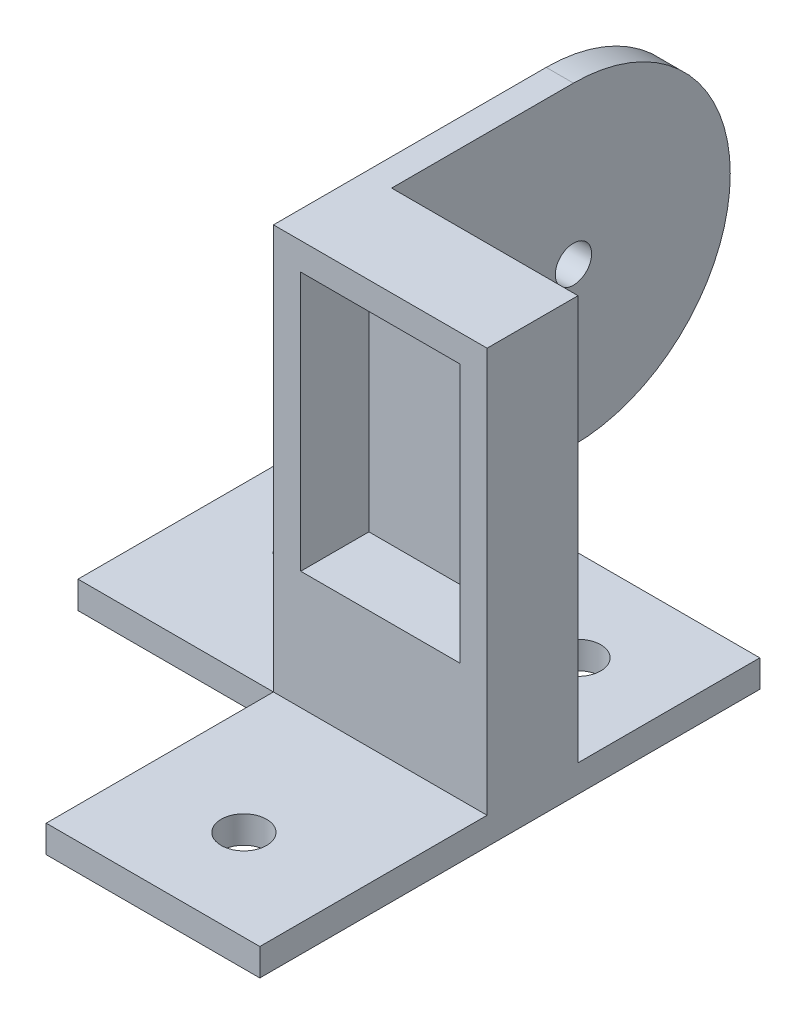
SolidWorks part; units mm, degrees
ref_plane "Alzado" through (0, 0, 0) normal (0, 0, 1) x (1, 0, 0)
ref_plane "Planta" through (0, 0, 0) normal (0, 1, 0) x (1, 0, 0)
ref_plane "Vista lateral" through (0, 0, 0) normal (1, 0, 0) x (0, 0, -1)
sketch "Croquis1" plane through (0, 0, 0) normal (0, 0, 1) x (1, 0, 0)
  line L0 (-11.75, 17.5) -> (-11.75, -17)
  line L1 (-8.75, 14.5) -> (8.75, 14.5)
  line L2 (-8.75, 14.5) -> (-8.75, -14)
  line L3 (-8.75, -14) -> (8.75, -14)
  line L4 (8.75, 14.5) -> (8.75, -14)
  line L5 (-11.75, -17) -> (11.75, -17)
  line L6 (11.75, 17.5) -> (11.75, -17)
  line L7 (-11.75, 17.5) -> (11.75, 17.5)
  dimension "D1" = 8.75
  dimension "D2" = 17.5
  dimension "D3" = 14.5
  dimension "D4" = 28.5
  dimension "D5" = 3
extrude "Saliente-Extruir1" add sketch "Croquis1" along normal blind 10
sketch "Croquis2" plane through (-11.75, 0, 0) normal (-1, 0, 0) x (0, 0, 1)
  line L1 (0, 17.5) -> (-20, 17.5)
  line L2 (0, 17.5) -> (0, -17)
  line L3 (0, -17) -> (-20, -17)
  arc A0 (-20, 17.5) -> (-20, -17) centre (-20, 0.25) ccw
  circle A1 centre (-20, 0.25) radius 2
  dimension "D3" = 4
  dimension "D1" = 34.5
  dimension "D2" = 20
extrude "Saliente-Extruir2" add sketch "Croquis2" against normal up to surface (3 mm away)
sketch "Croquis3" plane through (0, -17, 0) normal (0, -1, 0) x (1, 0, 0)
  line L12 (-11.75, 10) -> (-11.75, -20)
  line L13 (-11.75, -20) -> (-8.75, -20)
  line L14 (-8.75, -20) -> (-8.75, 0)
  line L15 (-8.75, 0) -> (11.75, 0)
  line L16 (11.75, 0) -> (11.75, 10)
  line L17 (11.75, 10) -> (-11.75, 10)
  line L18 (-11.75, 10) -> (-11.75, -20)
  line L19 (-11.75, -20) -> (-8.75, -20)
  line L20 (-8.75, -20) -> (-8.75, 0)
  line L21 (-8.75, 0) -> (11.75, 0)
  line L22 (11.75, 0) -> (11.75, 10)
  line L23 (11.75, 10) -> (-11.75, 10)
  dimension "D1" = 0
extrude "Saliente-Extruir3" add sketch "Croquis3" along normal blind 10
sketch "Croquis4" plane through (0, -27, 0) normal (0, -1, 0) x (1, 0, 0)
  line L1 (-11.75, -20) -> (-33.25, -20)
  line L2 (-11.75, 10) -> (-11.75, 10.0008)
  line L3 (-11.75, 10.0008) -> (-33.25, 10.0008)
  line L4 (-33.25, -20) -> (-33.25, 10.0008)
  line L6 (11.75, 10) -> (11.75, 35)
  line L7 (11.75, 35) -> (-11.75, 35)
  line L8 (-11.75, 10) -> (-11.75, 35)
  line L10 (11.75, 0) -> (11.75, -20)
  line L11 (11.75, -20) -> (-8.75, -20)
  line L24 (11.75, 10) -> (-11.75, 10)
  line L25 (-11.75, 10) -> (-11.75, -20)
  line L26 (-11.75, -20) -> (-8.75, -20)
  line L27 (-8.75, -20) -> (-8.75, 0)
  line L28 (-8.75, 0) -> (11.75, 0)
  line L29 (11.75, 0) -> (11.75, 10)
  line L32 (-11.75, -20) -> (-8.75, -20)
  line L35 (11.75, 0) -> (11.75, 10)
  dimension "D2" = 55
  dimension "D3" = 45
  dimension "D4" = 25
  dimension "D1" = 0
extrude "Saliente-Extruir4" add sketch "Croquis4" along normal blind 3 contours L4 L1 L2 L3 M13 | L11 L10 M16 M15 | L8 L2 L6 L7 M12 | M17 M12 M13 M14 M15 M16
sketch "Croquis5" plane through (0, -30, 0) normal (0, -1, 0) x (1, 0, 0)
  line L0 (-33.25, -20) -> (-33.25, 10.0008) construction
  line L1 (11.75, -20) -> (-33.25, -20) construction
  line L2 (11.75, 35) -> (11.75, -20) construction
  line L3 (-11.75, 10.0008) -> (-33.25, 10.0008) construction
  line L4 (11.75, 35) -> (-11.75, 35) construction
  circle A0 centre (-23.25, -4.9992) radius 2.5
  circle A1 centre (1.75, -10) radius 2.5
  circle A2 centre (0, 25) radius 2.5
  dimension "D4" = 5
  dimension "D5" = 5
  dimension "D6" = 5
  dimension "D1" = 10
  dimension "D2" = 10
  dimension "D3" = 11.75
  dimension "D7" = 15
  dimension "D8" = 10
  dimension "D9" = 10
extrude "Cortar-Extruir1" cut sketch "Croquis5" against normal up to surface (3 mm away)
sketch "Croquis6" plane through (0, 0, 0) normal (0, 0, -1) x (-1, 0, 0)
  line L1 (-8.75, -14) -> (8.75, -14)
  line L2 (-8.75, -14) -> (-8.75, 14.5)
  line L3 (-8.75, 14.5) -> (8.75, 14.5)
  line L4 (8.75, -14) -> (8.75, 14.5)
extrude "Saliente-Extruir5" add sketch "Croquis6" against normal blind 2.5
